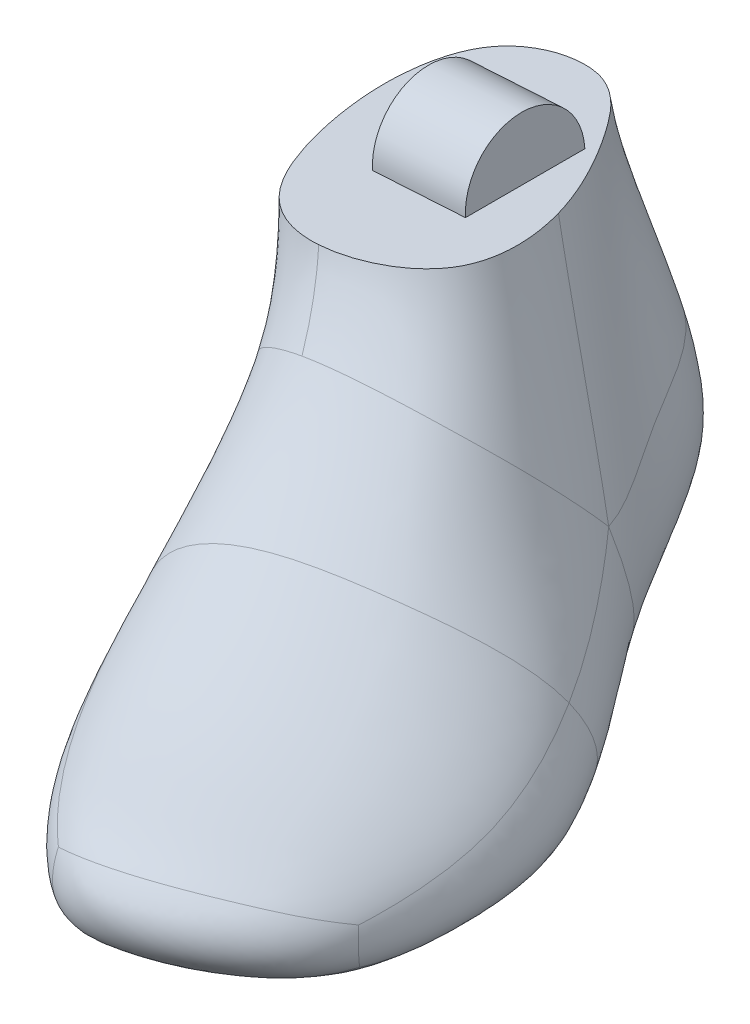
SolidWorks part; units mm, degrees
ref_plane "Front Plane" through (0, 0, 0) normal (0, 0, 1) x (1, 0, 0)
ref_plane "Top Plane" through (0, 0, 0) normal (0, 1, 0) x (1, 0, 0)
ref_plane "Right Plane" through (0, 0, 0) normal (1, 0, 0) x (0, 0, -1)
imported_body "Stock-Source-1"
sketch "Sketch1" plane through (0, 0, 0) normal (0, 0, 1) x (1, 0, 0)
  line L0 (205.2757, 2860.6357) -> (236.929, 2862.5365)
  line L1 (218.8404, 2861.4503) -> (191.711, 2859.8211) construction
  line L2 (255.0176, 2863.6228) -> (218.8404, 2861.4503) construction
  line L3 (236.929, 2862.5365) -> (235.7109, 2882.82)
  line L4 (235.7109, 2882.82) -> (204.0576, 2880.9191)
  line L5 (204.0576, 2880.9191) -> (205.2757, 2860.6357)
  dimension "D1" = 20.32
revolve "Revolve1" add sketch "Sketch1" angle 360 about L0
